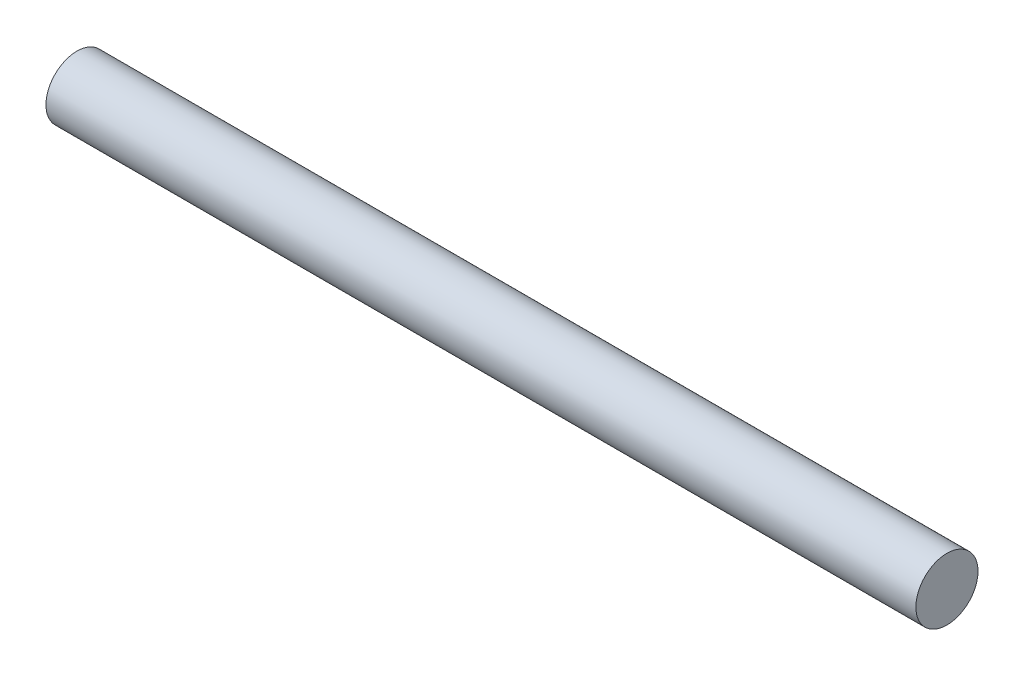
SolidWorks part; units mm, degrees
ref_plane "Front Plane" through (0, 0, 0) normal (0, 0, 1) x (1, 0, 0)
ref_plane "Top Plane" through (0, 0, 0) normal (0, 1, 0) x (1, 0, 0)
ref_plane "Right Plane" through (0, 0, 0) normal (1, 0, 0) x (0, 0, -1)
sketch "Sketch1" plane through (0, 0, 0) normal (1, 0, 0) x (0, 0, -1)
  circle A0 centre (0, 0) radius 3.175
  dimension "D1" = 6.35
extrude "Boss-Extrude1" add sketch "Sketch1" along normal mid plane 88.9
